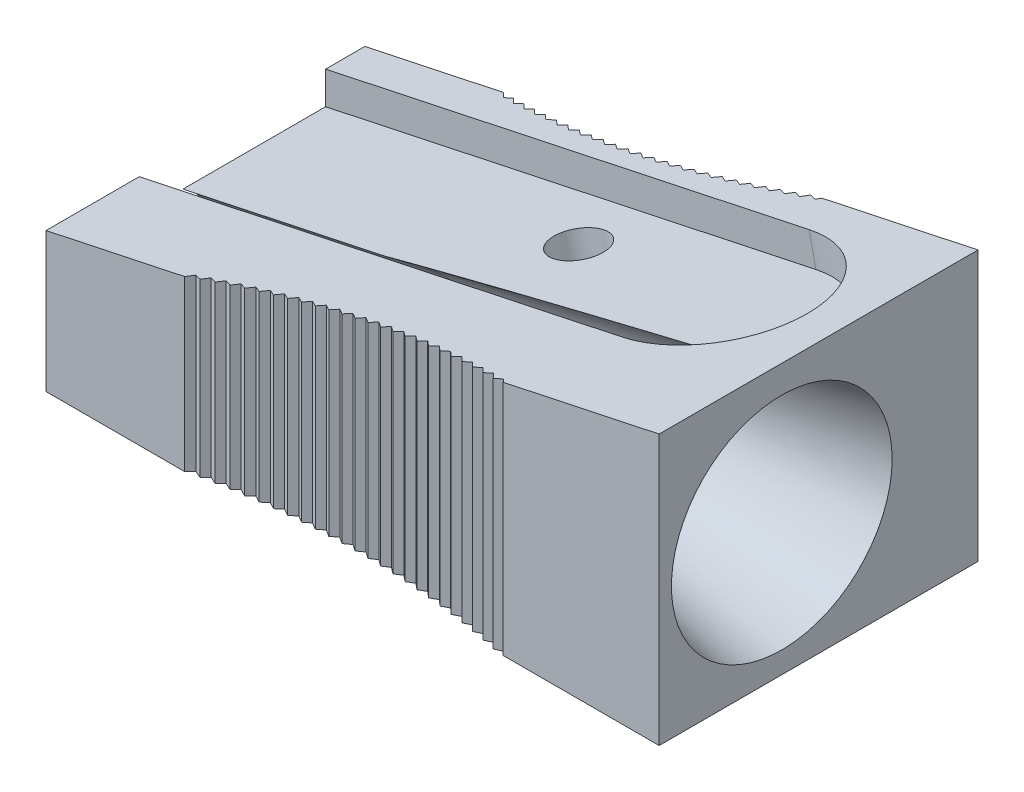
SolidWorks part; units mm, degrees
ref_plane "front" through (0, 0, 0) normal (0, 0, 1) x (1, 0, 0)
ref_plane "top" through (0, 0, 0) normal (0, 1, 0) x (1, 0, 0)
ref_plane "right" through (0, 0, 0) normal (1, 0, 0) x (0, 0, -1)
sketch "base profile" plane through (0, 0, 0) normal (0, 0, 1) x (1, 0, 0)
  line L0 (0, 0) -> (0, -11)
  line L1 (0, -11) -> (-25, -11)
  line L2 (-25, -11) -> (-25, -5.3139)
  line L3 (-25, -5.3139) -> (0, 0)
  dimension "D1" = 25
  dimension "D2" = 11
  dimension "D3" = 78
extrude "base shape" add sketch "base profile" along normal blind 13
ref_plane "Cut plane" through (0, 0, 8) normal (0, 0, 1) x (1, 0, 0)
sketch "pencil angle" plane through (0, 0, 8) normal (0, 0, 1) x (1, 0, 0)
  line L0 (4, -5.6246) -> (-22.5, -5.6246) construction
  line L1 (-17.737, -4.8947) -> (-17.737, -5.6246)
  line L3 (0, -11) -> (0, 0) construction
  line L4 (0, -1.1246) -> (-17.737, -4.8947)
  line L5 (0, 0) -> (-25, -5.3139) construction
  line L6 (0, -5.6246) -> (0, -1.1246)
  line L7 (-17.737, -5.6246) -> (0, -5.6246)
  dimension "D1" = 1.1
  dimension "D2" = 12
  dimension "D4" = 18.4
  dimension "D5" = 4.5
revolve "pencil cut" cut sketch "pencil angle" angle 360 about L0
sketch "lead felief profile" plane through (0, 0, 8) normal (0, 0, 1) x (1, 0, 0)
  line L0 (-25, -8) -> (-10.5165, -4.9214) construction
  line L1 (-25, -5.3139) -> (-25, -11) construction
  line L2 (0, 0) -> (-25, -5.3139) construction
  line L3 (-26.3978, -6.8147) -> (-9.4686, -3.2163)
  line L5 (-9.4686, -3.2163) -> (-9.1672, -4.6346)
  line L6 (-26.3978, -6.8147) -> (-26.0963, -8.233)
  line L7 (-26.0963, -8.233) -> (-9.1672, -4.6346)
  dimension "D1" = 3
  dimension "D2" = 10
  dimension "D3" = 1.45
revolve "Lead relief" cut sketch "lead felief profile" angle 360 about L0
ref_plane "Plane5" through (0, 0, 0) normal (-0.9781, -0.2079, 0) x (0, 0, 1)
sketch "balde shape" plane through (0, 0, 0) normal (-0.2079, 0.9781, 0) x (-0.9781, -0.2079, 0)
  line L2 (5.4, 1.6) -> (29.1088, 1.6)
  line L3 (5.4, 9.2) -> (29.1088, 9.2)
  line L5 (0, -6.7091) -> (0, 6.7091) construction
  line L6 (29.1088, 9.2) -> (29.1088, 1.6)
  arc A0 (5.4, 1.6) -> (5.4, 9.2) centre (5.4, 5.4) cw
  dimension "D3" = 5.4
  dimension "D2" = 7.6
extrude "blade recess" cut sketch "balde shape" against normal blind 1.3
sketch "hole position" plane through (0.2703, -1.2716, 0) normal (-0.2079, 0.9781, 0) x (-0.9781, -0.2079, 0)
  line L0 (25.8348, 7.4164) -> (25.8348, 1.6) construction
  line L1 (0, 0) -> (25.5585, 0) construction
  point P0 (12.8348, 4)
  dimension "D1" = 13
  dimension "D2" = 4
hole_wizard "M2.5x0.45 Tapped Hole3" positions "3DSketch3" profile "Sketch9" tap size "M2.5x0.45" standard "ISO"
sketch3d "3DSketch3"
  point P0 (-12.2841, -3.9401, 4)
sketch "Sketch9" plane through (-12.2841, -3.9401, 4) normal (0, 0, 1) x (-0.9781, -0.2079, 0)
  line L0 (0, 0) -> (0, 5.1159)
  line L1 (0, 5.1159) -> (1.025, 4.5)
  line L2 (1.025, 4.5) -> (1.025, 0)
  line L5 (1.025, 0) -> (0, 0)
  line L10 (0, 5.1159) -> (-1.025, 4.5) construction
  line L11 (0, -6.35) -> (0, 107.95) construction
  dimension "Tap Drill Dia." = 2.05
  dimension "Tap Drill Depth" = 4.5
  dimension "Drill Angle" = 118
sketch "Sketch10" plane through (0, 0, 0) normal (0, 1, 0) x (1, 0, 0)
  line L0 (-13, 0) -> (-13, -74) construction
  line L1 (-18.3098, -12.7966) -> (-18.6027, -12.6634)
  line L2 (-18.8273, -12.8938) -> (-18.6027, -12.6634)
  line L3 (0, -6.5) -> (-25, -6.5) construction
  line L4 (0, -13) -> (0, 0) construction
  line L5 (-25, -7.4164) -> (-25, -1.6) construction
  line L6 (0, 0) -> (-25, 0) construction
  line L7 (0, -13) -> (-25, -13) construction
  line L8 (-13, -42.5) -> (-19.4209, -11.3169) construction
  line L9 (-18.8273, -12.8938) -> (-19.1226, -12.7657)
  line L10 (-19.3432, -13) -> (-19.1226, -12.7657)
  line L11 (-13, -42.5) -> (-18.8273, -12.8938) construction
  line L12 (-17.7906, -12.7085) -> (-18.0811, -12.5702)
  line L13 (-18.3098, -12.7966) -> (-18.0811, -12.5702)
  line L14 (-17.2699, -12.6294) -> (-17.558, -12.4861)
  line L15 (-17.7906, -12.7085) -> (-17.558, -12.4861)
  line L16 (-16.7479, -12.5594) -> (-17.0335, -12.4111)
  line L17 (-17.2699, -12.6294) -> (-17.0335, -12.4111)
  line L18 (-16.2248, -12.4986) -> (-16.5077, -12.3453)
  line L19 (-16.7479, -12.5594) -> (-16.5077, -12.3453)
  line L20 (-15.7007, -12.4469) -> (-15.9809, -12.2886)
  line L21 (-16.2248, -12.4986) -> (-15.9809, -12.2886)
  line L22 (-15.1758, -12.4043) -> (-15.4532, -12.2412)
  line L23 (-15.7007, -12.4469) -> (-15.4532, -12.2412)
  line L24 (-14.6502, -12.3709) -> (-14.9248, -12.203)
  line L25 (-15.1758, -12.4043) -> (-14.9248, -12.203)
  line L26 (-14.1242, -12.3467) -> (-14.3957, -12.174)
  line L27 (-14.6502, -12.3709) -> (-14.3957, -12.174)
  line L28 (-13.5978, -12.3317) -> (-13.8662, -12.1543)
  line L29 (-14.1242, -12.3467) -> (-13.8662, -12.1543)
  line L30 (-13.0712, -12.3258) -> (-13.3365, -12.1438)
  line L31 (-13.5978, -12.3317) -> (-13.3365, -12.1438)
  line L32 (-12.5445, -12.3292) -> (-12.8067, -12.1425)
  line L33 (-13.0712, -12.3258) -> (-12.8067, -12.1425)
  line L34 (-12.018, -12.3417) -> (-12.2769, -12.1505)
  line L35 (-12.5445, -12.3292) -> (-12.2769, -12.1505)
  line L36 (-11.4919, -12.3635) -> (-11.7473, -12.1678)
  line L37 (-12.018, -12.3417) -> (-11.7473, -12.1678)
  line L38 (-10.9661, -12.3944) -> (-11.2181, -12.1943)
  line L39 (-11.4919, -12.3635) -> (-11.2181, -12.1943)
  line L40 (-10.441, -12.4344) -> (-10.6895, -12.23)
  line L41 (-10.9661, -12.3944) -> (-10.6895, -12.23)
  line L42 (-9.9167, -12.4837) -> (-10.1616, -12.2749)
  line L43 (-10.441, -12.4344) -> (-10.1616, -12.2749)
  line L44 (-9.3933, -12.5421) -> (-9.6345, -12.3291)
  line L45 (-9.9167, -12.4837) -> (-9.6345, -12.3291)
  line L46 (-8.871, -12.6096) -> (-9.1085, -12.3924)
  line L47 (-9.3933, -12.5421) -> (-9.1085, -12.3924)
  line L48 (-8.35, -12.6862) -> (-8.5836, -12.4649)
  line L49 (-8.871, -12.6096) -> (-8.5836, -12.4649)
  line L50 (-7.8304, -12.7719) -> (-8.0601, -12.5465)
  line L51 (-8.35, -12.6862) -> (-8.0601, -12.5465)
  line L52 (-7.3123, -12.8666) -> (-7.5381, -12.6373)
  line L53 (-7.8304, -12.7719) -> (-7.5381, -12.6373)
  line L54 (-6.796, -12.9704) -> (-7.0177, -12.7372)
  line L55 (-7.3123, -12.8666) -> (-7.0177, -12.7372)
  line L56 (-6.2816, -13.0832) -> (-6.4992, -12.8461)
  line L57 (-6.796, -12.9704) -> (-6.4992, -12.8461)
  line L58 (-13, -42.5) -> (-19.3432, -13) construction
  line L59 (-13, -42.5) -> (-18.8273, -12.8938) construction
  arc A0 (-19.3432, -13) -> (-6.6568, -13) centre (-13, -42.5) cw construction
  dimension "D2" = 179
extrude "Grip" cut sketch "Sketch10" against normal through all and the other way through all
sketch "Sketch12" plane through (0, 0, 0) normal (0, -1, 0) x (1, 0, 0)
  line L0 (-13, 13) -> (-13, -61) construction
  line L1 (-18.3098, 0.2034) -> (-18.6027, 0.3366)
  line L2 (-18.8273, 0.1062) -> (-18.6027, 0.3366)
  line L3 (0, 6.5) -> (-25, 6.5) construction
  line L8 (-13, -29.5) -> (-19.4209, 1.6831) construction
  line L9 (-18.8273, 0.1062) -> (-19.1226, 0.2343)
  line L10 (-19.3432, 0) -> (-19.1226, 0.2343)
  line L11 (-13, -29.5) -> (-18.8273, 0.1062) construction
  line L12 (-17.7906, 0.2915) -> (-18.0811, 0.4298)
  line L13 (-18.3098, 0.2034) -> (-18.0811, 0.4298)
  line L14 (-17.2699, 0.3706) -> (-17.558, 0.5139)
  line L15 (-17.7906, 0.2915) -> (-17.558, 0.5139)
  line L16 (-16.7479, 0.4406) -> (-17.0335, 0.5889)
  line L17 (-17.2699, 0.3706) -> (-17.0335, 0.5889)
  line L18 (-16.2248, 0.5014) -> (-16.5077, 0.6547)
  line L19 (-16.7479, 0.4406) -> (-16.5077, 0.6547)
  line L20 (-15.7007, 0.5531) -> (-15.9809, 0.7114)
  line L21 (-16.2248, 0.5014) -> (-15.9809, 0.7114)
  line L22 (-15.1758, 0.5957) -> (-15.4532, 0.7588)
  line L23 (-15.7007, 0.5531) -> (-15.4532, 0.7588)
  line L24 (-14.6502, 0.6291) -> (-14.9248, 0.797)
  line L25 (-15.1758, 0.5957) -> (-14.9248, 0.797)
  line L26 (-14.1242, 0.6533) -> (-14.3957, 0.826)
  line L27 (-14.6502, 0.6291) -> (-14.3957, 0.826)
  line L28 (-13.5978, 0.6683) -> (-13.8662, 0.8457)
  line L29 (-14.1242, 0.6533) -> (-13.8662, 0.8457)
  line L30 (-13.0712, 0.6742) -> (-13.3365, 0.8562)
  line L31 (-13.5978, 0.6683) -> (-13.3365, 0.8562)
  line L32 (-12.5445, 0.6708) -> (-12.8067, 0.8575)
  line L33 (-13.0712, 0.6742) -> (-12.8067, 0.8575)
  line L34 (-12.018, 0.6583) -> (-12.2769, 0.8495)
  line L35 (-12.5445, 0.6708) -> (-12.2769, 0.8495)
  line L36 (-11.4919, 0.6365) -> (-11.7473, 0.8322)
  line L37 (-12.018, 0.6583) -> (-11.7473, 0.8322)
  line L38 (-10.9661, 0.6056) -> (-11.2181, 0.8057)
  line L39 (-11.4919, 0.6365) -> (-11.2181, 0.8057)
  line L40 (-10.441, 0.5656) -> (-10.6895, 0.77)
  line L41 (-10.9661, 0.6056) -> (-10.6895, 0.77)
  line L42 (-9.9167, 0.5163) -> (-10.1616, 0.7251)
  line L43 (-10.441, 0.5656) -> (-10.1616, 0.7251)
  line L44 (-9.3933, 0.4579) -> (-9.6345, 0.6709)
  line L45 (-9.9167, 0.5163) -> (-9.6345, 0.6709)
  line L46 (-8.871, 0.3904) -> (-9.1085, 0.6076)
  line L47 (-9.3933, 0.4579) -> (-9.1085, 0.6076)
  line L48 (-8.35, 0.3138) -> (-8.5836, 0.5351)
  line L49 (-8.871, 0.3904) -> (-8.5836, 0.5351)
  line L50 (-7.8304, 0.2281) -> (-8.0601, 0.4535)
  line L51 (-8.35, 0.3138) -> (-8.0601, 0.4535)
  line L52 (-7.3123, 0.1334) -> (-7.5381, 0.3627)
  line L53 (-7.8304, 0.2281) -> (-7.5381, 0.3627)
  line L54 (-6.796, 0.0296) -> (-7.0177, 0.2628)
  line L55 (-7.3123, 0.1334) -> (-7.0177, 0.2628)
  line L56 (-6.2816, -0.0832) -> (-6.4992, 0.1539)
  line L57 (-6.796, 0.0296) -> (-6.4992, 0.1539)
  line L58 (-13, -29.5) -> (-19.3432, 0) construction
  line L59 (-13, -29.5) -> (-18.8273, 0.1062) construction
  line L60 (0, 6.5) -> (-25, 6.5) construction
  line L61 (0, 13) -> (0, 0) construction
  arc A0 (-19.3432, 0) -> (-6.6568, 0) centre (-13, -29.5) cw construction
  point P10 (-13, 6.5)
  dimension "D1" = 36
  dimension "D2" = 179
extrude "Grip2" cut sketch "Sketch12" against normal through all and the other way through all
